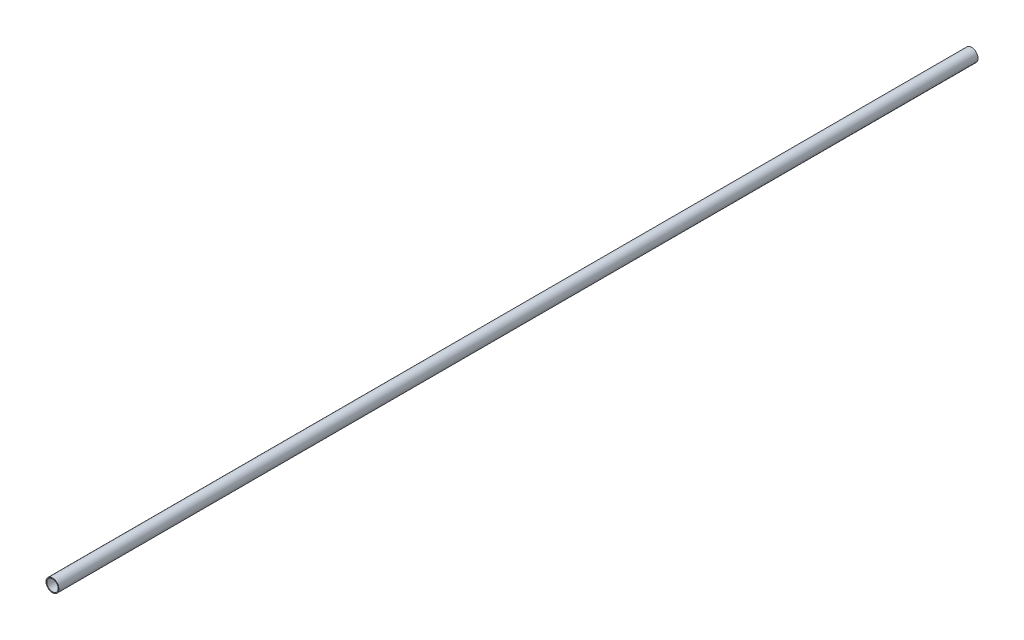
SolidWorks part; units mm, degrees
ref_plane "Face" through (0, 0, 0) normal (0, 0, 1) x (1, 0, 0)
ref_plane "Dessus" through (0, 0, 0) normal (0, 1, 0) x (1, 0, 0)
ref_plane "Droite" through (0, 0, 0) normal (1, 0, 0) x (0, 0, -1)
sketch "Esquisse1" plane through (0, 0, 0) normal (0, 0, 1) x (1, 0, 0)
  circle A0 centre (0, 0) radius 0.4
  circle A1 centre (0, 0) radius 0.35
  dimension "D1" = 0.8
  dimension "D2" = 0.7
extrude "Extrusion1" add sketch "Esquisse1" along normal blind 57
ref_point "Point1"
